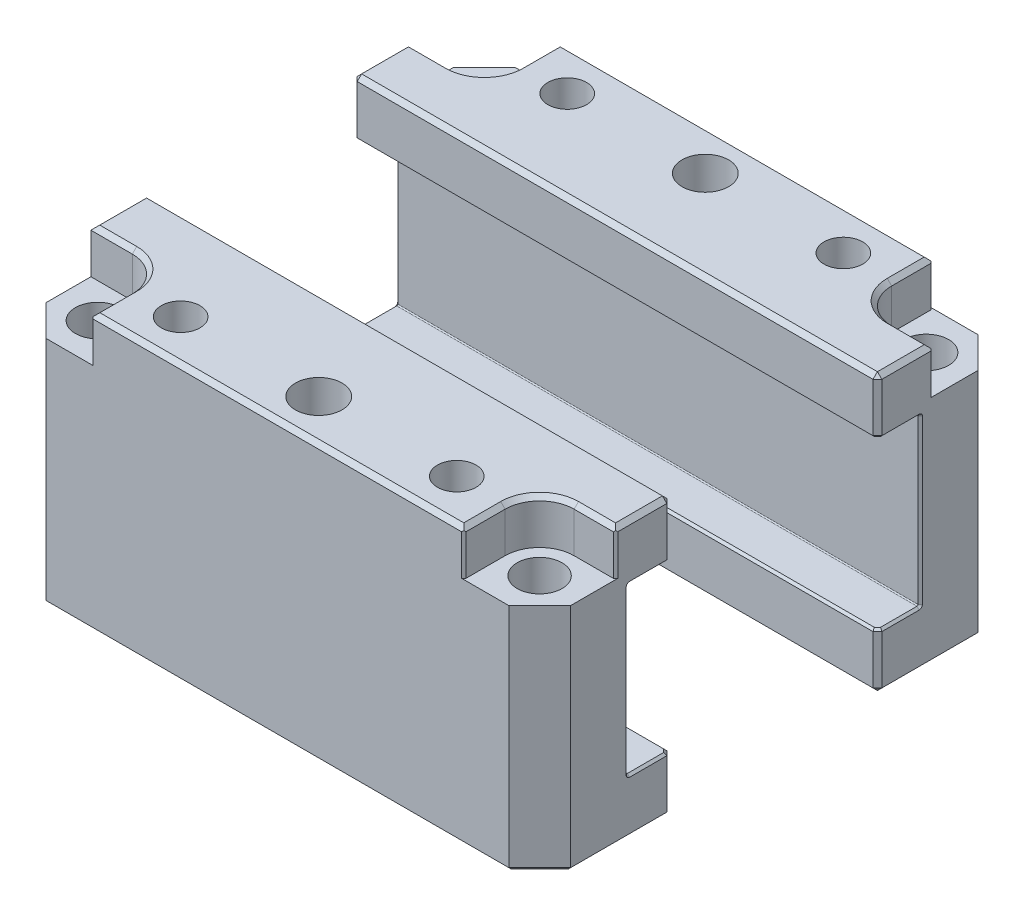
SolidWorks part; units mm, degrees
ref_plane "Front Plane" through (0, 0, 0) normal (0, 0, 1) x (1, 0, 0)
ref_plane "Top Plane" through (0, 0, 0) normal (0, 1, 0) x (1, 0, 0)
ref_plane "Right Plane" through (0, 0, 0) normal (1, 0, 0) x (0, 0, -1)
sketch "Sketch1" plane through (0, 0, 0) normal (1, 0, 0) x (0, 0, -1)
  line L0 (-23.7109, 0) -> (-23.7109, 63.5)
  line L1 (-23.7109, 63.5) -> (-53.9496, 63.5)
  line L2 (-53.9496, 63.5) -> (-53.9496, 0)
  line L3 (-53.9496, 0) -> (-23.7109, 0)
  line L4 (0, 48.255) -> (0, -16.2311) construction
  dimension "D1" = 47.4218
  dimension "D2" = 63.5
  dimension "D3" = 107.8992
  dimension "D4" = 30.2387
extrude "Boss-Extrude1" add sketch "Sketch1" along normal mid plane 120.65
hole_wizard "CBORE for 3/8 Socket Head Cap Screw3" positions "Sketch4" profile "Sketch3" counterbore size "3/8" standard "ANSI Inch"
sketch "Sketch4" plane through (0, 63.5, 0) normal (0, 1, 0) x (1, 0, 0)
  line L0 (0, 7.4267) -> (0, -36.2312) construction
  line L2 (-19.6518, 0) -> (14.0148, 0) construction
  point P0 (-50.8, -44.45)
  point P11 (50.8, -44.45)
  dimension "D1" = 101.6
  dimension "D2" = 88.9
sketch "Sketch3" plane through (-50.8, 63.5, 44.45) normal (1, 0, 0) x (0, 0, 1)
  line L0 (0, 0) -> (0, 63.5)
  line L1 (0, 63.5) -> (5.1587, 63.5)
  line L3 (5.1587, 63.5) -> (5.1587, 10.287)
  line L4 (5.1587, 10.287) -> (7.9375, 10.287)
  line L5 (7.9375, 10.287) -> (7.9375, 0)
  line L7 (7.9375, 0) -> (0, 0)
  line L11 (0, -6.35) -> (0, 107.95) construction
  dimension "Thru Hole Dia." = 10.3175
  dimension "Thru Hole Depth" = 63.5
  dimension "C'Bore Dia." = 15.875
  dimension "C'Bore Depth" = 10.287
hole_wizard "1/2-13 Tapped Hole1" positions "Sketch6" profile "Sketch5" tap size "1/2-13" standard "ANSI Inch"
sketch "Sketch6" plane through (0, 63.5, 0) normal (0, 1, 0) x (1, 0, 0)
  line L0 (0, 2.7703) -> (0, -32.9614) construction
  line L2 (-8.3627, 0) -> (4.6629, 0) construction
  line L4 (50.8, -44.45) -> (-50.8, -44.45) construction
  point P2 (0, -44.45)
sketch "Sketch5" plane through (0, 63.5, 44.45) normal (1, 0, 0) x (0, 0, 1)
  line L0 (0, 0) -> (0, 38.3985)
  line L1 (0, 38.3985) -> (5.3581, 35.179)
  line L2 (5.3581, 35.179) -> (5.3581, 0)
  line L5 (5.3581, 0) -> (0, 0)
  line L10 (0, 38.3985) -> (-5.3581, 35.179) construction
  line L11 (0, -6.35) -> (0, 107.95) construction
  dimension "Tap Drill Dia." = 10.7163
  dimension "Tap Drill Depth" = 35.179
  dimension "Drill Angle" = 118
chamfer "Chamfer1" distance 7.112 angle 45 2 edges at (60.325, 31.75, 53.9496) (-60.325, 31.75, 53.9496)
ref_plane "Plane2" through (0, 0, 44.45) normal (0, 0, 1) x (1, 0, 0)
sketch "Sketch16" plane through (0, 0, 44.45) normal (0, 0, 1) x (1, 0, 0)
  line L0 (-36.195, 63.5) -> (-36.195, 22.7968)
  line L1 (-36.195, 22.7968) -> (-36.5125, 22.606)
  line L2 (-36.5125, 22.606) -> (-36.5125, 0)
  line L3 (-36.5125, 0) -> (-31.75, 0)
  line L4 (-31.75, 0) -> (-31.75, 63.5)
  line L5 (-31.75, 63.5) -> (-36.195, 63.5)
  line L6 (-31.75, 70.1371) -> (-31.75, -4.206) construction
  line L7 (53.213, 0) -> (-53.213, 0) construction
  line L8 (53.213, 63.5) -> (-53.213, 63.5) construction
  line L9 (0, 0) -> (0, 70.1371) construction
  dimension "D1" = 22.606
  dimension "D2" = 59
  dimension "D3" = 8.89
  dimension "D4" = 9.525
  dimension "D5" = 63.5
revolve "Cut-Revolve1" cut sketch "Sketch16" angle 360 about L6
mirror "Mirror1" about plane through (0, 0, 0) normal (1, 0, 0) of "Cut-Revolve1"
sketch "Sketch8" plane through (0, 63.5, 0) normal (0, 1, 0) x (1, 0, 0)
  line L0 (0, -16.6286) -> (0, -66.1356) construction
  line L2 (-50.8, -36.5125) -> (-60.325, -36.5125)
  line L4 (-42.8625, -44.45) -> (-42.8625, -53.9496)
  line L5 (53.213, -53.9496) -> (-53.213, -53.9496) construction
  line L6 (-42.8625, -53.9496) -> (-60.325, -53.9496)
  line L7 (-60.325, -53.9496) -> (-60.325, -36.5125)
  line L9 (-60.325, -23.7109) -> (-60.325, -46.8376) construction
  line L10 (60.325, -53.9496) -> (60.325, -36.5125)
  line L11 (42.8625, -53.9496) -> (60.325, -53.9496)
  line L12 (42.8625, -44.45) -> (42.8625, -53.9496)
  line L13 (50.8, -36.5125) -> (60.325, -36.5125)
  circle A0 centre (-50.8, -44.45) radius 7.9375 construction
  circle A1 centre (-50.8, -44.45) radius 7.9375 construction
  arc A2 (-50.8, -36.5125) -> (-42.8625, -44.45) centre (-50.8, -44.45) cw
  arc A3 (50.8, -36.5125) -> (42.8625, -44.45) centre (50.8, -44.45) ccw
extrude "Cut-Extrude3" cut sketch "Sketch8" against normal up to surface (10.287 mm away)
sketch "Sketch9" plane through (0, 0, 23.7109) normal (0, 0, -1) x (-1, 0, 0)
  line L0 (0, 63.5) -> (0, 0) construction
  line L1 (-60.325, 63.5) -> (60.325, 63.5) construction
  line L2 (60.325, 0) -> (60.325, 63.5) construction
  line L3 (-60.325, 50.7492) -> (60.325, 50.7492)
  line L4 (-60.325, 50.7492) -> (-60.325, 12.7508)
  line L5 (-60.325, 12.7508) -> (60.325, 12.7508)
  line L6 (60.325, 50.7492) -> (60.325, 12.7508)
  line L7 (-60.325, 50.7492) -> (60.325, 12.7508) construction
  line L8 (-60.325, 12.7508) -> (60.325, 50.7492) construction
  point P5 (0, 31.75)
  dimension "D1" = 37.9984
extrude "Cut-Extrude4" cut sketch "Sketch9" against normal offset from surface (9.8425 mm away) 33.5534
hole_wizard "1/2-13 Tapped Hole2" positions "Sketch11" profile "Sketch10" tap size "1/2-13" standard "ANSI Inch"
sketch "Sketch11" plane through (0, 0, 0) normal (0, -1, 0) x (-1, 0, 0)
  point P0 (50.8, -44.45)
  point P3 (-50.8, -44.45)
sketch "Sketch10" plane through (-50.8, 0, 44.45) normal (1, 0, 0) x (0, 0, -1)
  line L0 (0, 0) -> (0, 38.3985)
  line L1 (0, 38.3985) -> (5.3581, 35.179)
  line L2 (5.3581, 35.179) -> (5.3581, 0)
  line L5 (5.3581, 0) -> (0, 0)
  line L10 (0, 38.3985) -> (-5.3581, 35.179) construction
  line L11 (0, -6.35) -> (0, 107.95) construction
  dimension "Tap Drill Dia." = 10.7163
  dimension "Tap Drill Depth" = 35.179
  dimension "Drill Angle" = 118
ref_plane "Plane1" through (0, 31.75, 0) normal (0, 1, 0) x (1, 0, 0)
fillet "Fillet1" radius 0.254 2 edges at (0, 12.7508, 33.5534) (0, 50.7492, 33.5534)
chamfer "Chamfer2" distance 1.016 angle 45 20 edges at (0, 0, 23.7109) (60.325, 6.3754, 23.7109) (60.325, 0, 35.2742) (56.769, 0, 50.3936) (0, 0, 53.9496) (-56.769, 0, 50.3936) (-60.325, 0, 35.2742) (-60.325, 6.3754, 23.7109) (-45.1873, 63.5, 38.8373) (0, 63.5, 53.9496) (-60.325, 63.5, 30.1117) (-60.325, 57.1246, 23.7109) (0, 63.5, 23.7109) (45.1873, 63.5, 38.8373) (60.325, 63.5, 30.1117) (60.325, 57.1246, 23.7109) (-42.8625, 63.5, 49.1998) (-55.5625, 63.5, 36.5125) (42.8625, 63.5, 49.1998) (55.5625, 63.5, 36.5125)
chamfer "Chamfer3" distance 0.508 angle 45 19 edges at (-59.817, 12.7508, 24.2189) (0, 12.7508, 23.7109) (59.817, 12.7508, 24.2189) (-60.325, 12.7508, 29.0132) (60.325, 12.7508, 29.0132) (-60.325, 12.8252, 33.479) (60.325, 12.8252, 33.479) (-60.325, 31.75, 33.5534) (60.325, 31.75, 33.5534) (-60.325, 50.6748, 33.479) (60.325, 50.6748, 33.479) (-60.325, 50.7492, 29.0132) (-59.817, 50.7492, 24.2189) (0, 50.7492, 23.7109) (59.817, 50.7492, 24.2189) (60.325, 50.7492, 29.0132) (60.325, 57.8485, 36.5125) (42.8625, 57.8485, 53.9496) (-42.8625, 57.8485, 53.9496)
chamfer "Chamfer4" distance 0.508 angle 45 2 edges at (36.5125, 0, 44.45) (-36.5125, 0, 44.45)
mirror "Mirror3" about plane through (0, 0, 0) normal (0, 0, 1)
